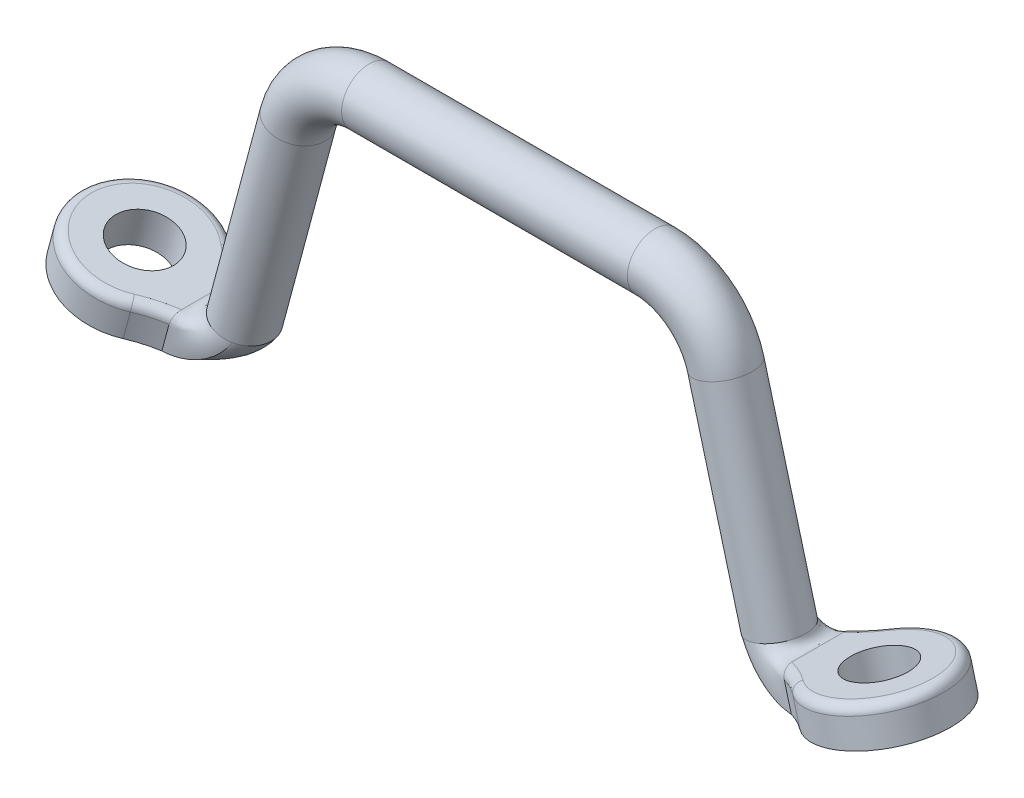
SolidWorks part; units mm, degrees
ref_plane "Front Plane" through (0, 0, 0) normal (0, 0, 1) x (1, 0, 0)
ref_plane "Top Plane" through (0, 0, 0) normal (0, 1, 0) x (1, 0, 0)
ref_plane "Right Plane" through (0, 0, 0) normal (1, 0, 0) x (0, 0, -1)
sketch "Sketch1" plane through (0, 0, 0) normal (0, 0, 1) x (1, 0, 0)
  line L0 (0, 57.6679) -> (-38.1, 57.6679) construction
  line L1 (-38.1, 57.6679) -> (-50.8371, 10.1323) construction
  line L2 (0, 52.9054) -> (-24.7006, 52.9054)
  line L3 (0, 57.6679) -> (0, 0) construction
  line L4 (-36.9678, 43.4924) -> (-46.2369, 8.8997)
  line L5 (0, 48.1429) -> (-24.7006, 48.1429) construction
  line L6 (-32.3676, 42.2598) -> (-41.6367, 7.667) construction
  line L7 (0, 48.1429) -> (-30.7912, 48.1429) construction
  line L8 (-30.7912, 48.1429) -> (-41.6367, 7.667) construction
  line L9 (0, 52.9054) -> (-34.4456, 52.9054) construction
  line L10 (-34.4456, 52.9054) -> (-46.2369, 8.8997) construction
  line L11 (-75.8926, 8.6284) -> (-43.6911, 0) construction
  line L12 (-75.0709, 11.6952) -> (-53.6032, 5.9429) construction
  line L13 (-74.2491, 14.762) -> (-52.7814, 9.0098) construction
  line L14 (-38.1, 57.6679) -> (-50.8371, 10.1323) construction
  line L15 (-74.2491, 14.762) -> (-45.7941, 7.1375) construction
  line L16 (-75.0709, 11.6952) -> (-46.6159, 4.0707) construction
  line L18 (-74.2491, 14.762) -> (-75.8926, 8.6284) construction
  line L19 (-53.6032, 5.9429) -> (-52.7814, 9.0098) construction
  arc A0 (-24.7006, 48.1429) -> (-32.3676, 42.2598) centre (-24.7006, 40.2054) ccw construction
  arc A1 (-24.7006, 52.9054) -> (-36.9678, 43.4924) centre (-24.7006, 40.2054) ccw
  arc A2 (-50.8371, 10.1323) -> (-52.7814, 9.0098) centre (-52.3705, 10.5432) cw construction
  arc A3 (-53.6032, 5.9429) -> (-46.2369, 8.8997) centre (-51.8912, 12.3321) ccw construction
  dimension "D5" = 7.9375
  dimension "D9" = 1.5875
  dimension "D3" = 4.7625
  dimension "D1" = 15
  dimension "D2" = 38.1
  dimension "D6" = 7.9375
  dimension "D10" = 57.15
  dimension "D11" = 33.3375
  dimension "D4" = 4.7625
  dimension "D8" = 3.175
sketch "Sketch2" plane through (0, 0, 0) normal (1, 0, 0) x (0, 0, -1)
  circle A0 centre (0, 52.9054) radius 4.7625
sweep "Sweep1" add profiles "Sketch2" path "Sketch1"
sketch "Sketch3" plane through (0, 0, 0) normal (0, 0, 1) x (1, 0, 0)
  line L0 (-74.2491, 14.762) -> (-52.7814, 9.0098) construction
  line L1 (-75.8926, 8.6284) -> (-43.6911, 0) construction
  line L2 (-74.2491, 14.762) -> (-75.8926, 8.6284) construction
  line L3 (-74.2491, 14.762) -> (-52.7814, 9.0098)
  line L4 (-75.8926, 8.6284) -> (-54.4249, 2.8761)
  line L5 (-74.2491, 14.762) -> (-75.8926, 8.6284)
  line L6 (-53.6032, 5.9429) -> (-52.7814, 9.0098) construction
  line L7 (-52.7814, 9.0098) -> (-54.4249, 2.8761)
extrude "Boss-Extrude1" add sketch "Sketch3" along normal mid plane 22.225 separate body
sketch "Sketch4" plane through (-1.2832, -4.7891, 0) normal (0.2588, 0.9659, 0) x (0.9659, -0.2588, 0)
  line L0 (-75.5398, -11.1125) -> (-75.5398, 11.1125) construction
  line L1 (-53.3148, -11.1125) -> (-53.3148, 11.1125) construction
  line L2 (-53.3148, -6.1215) -> (-53.3148, 6.2186)
  line L3 (-53.3148, 11.1125) -> (-75.5398, 11.1125) construction
  line L18 (-51.7273, 12.7) -> (-77.1273, 12.7)
  line L19 (-77.1273, 12.7) -> (-77.1273, -12.7)
  line L20 (-77.1273, -12.7) -> (-51.7273, -12.7)
  line L21 (-51.7273, -12.7) -> (-51.7273, 12.7)
  line L22 (-51.7273, 12.7) -> (-77.1273, 12.7)
  line L23 (-77.1273, 12.7) -> (-77.1273, -12.7)
  line L24 (-77.1273, -12.7) -> (-51.7273, -12.7)
  line L25 (-51.7273, -12.7) -> (-51.7273, 12.7)
  arc A0 (-57.5442, 8.7241) -> (-57.5442, -8.7241) centre (-64.4273, 0) ccw
  arc A1 (-57.5442, 8.7241) -> (-53.3148, 6.2186) centre (-46.0785, 23.2564) ccw
  arc A4 (-57.5442, -8.7241) -> (-53.3148, -6.1215) centre (-44.2945, -25.5176) cw
  dimension "D1" = 12.3401
  dimension "D2" = 4.8939
  dimension "D3" = 4.2294
  dimension "D4" = 1.5875
extrude "Cut-Extrude3" cut sketch "Sketch4" against normal through all
fillet "Fillet5" radius 1.5875 3 edges at (-54.9047, 9.5787, -7.3304) (-54.8972, 9.5767, 7.2996) (-74.2491, 14.762, 0)
sketch "Sketch5" plane through (0, 0, 0) normal (0, 0, 1) x (1, 0, 0)
  line L0 (-75.8926, 8.6284) -> (-43.6911, 0) construction
  arc A2 (-54.4249, 2.8761) -> (-41.6367, 7.667) centre (-51.3844, 14.2233) ccw
  arc A3 (-52.7814, 9.0098) -> (-50.8371, 10.1323) centre (-52.3705, 10.5432) ccw construction
  arc A4 (-52.7814, 9.0098) -> (-50.8371, 10.1323) centre (-52.3705, 10.5432) ccw
loft "Loft1" add
sketch "Sketch6" plane through (-1.2832, -4.7891, 0) normal (0.2588, 0.9659, 0) x (0.9659, -0.2588, 0)
  circle A0 centre (-64.4273, 0) radius 5.1594
  dimension "D1" = 10.3187
extrude "Cut-Extrude4" cut sketch "Sketch6" against normal through all
mirror "Mirror1" about plane through (0, 52.9054, 0) normal (1, 0, 0)
